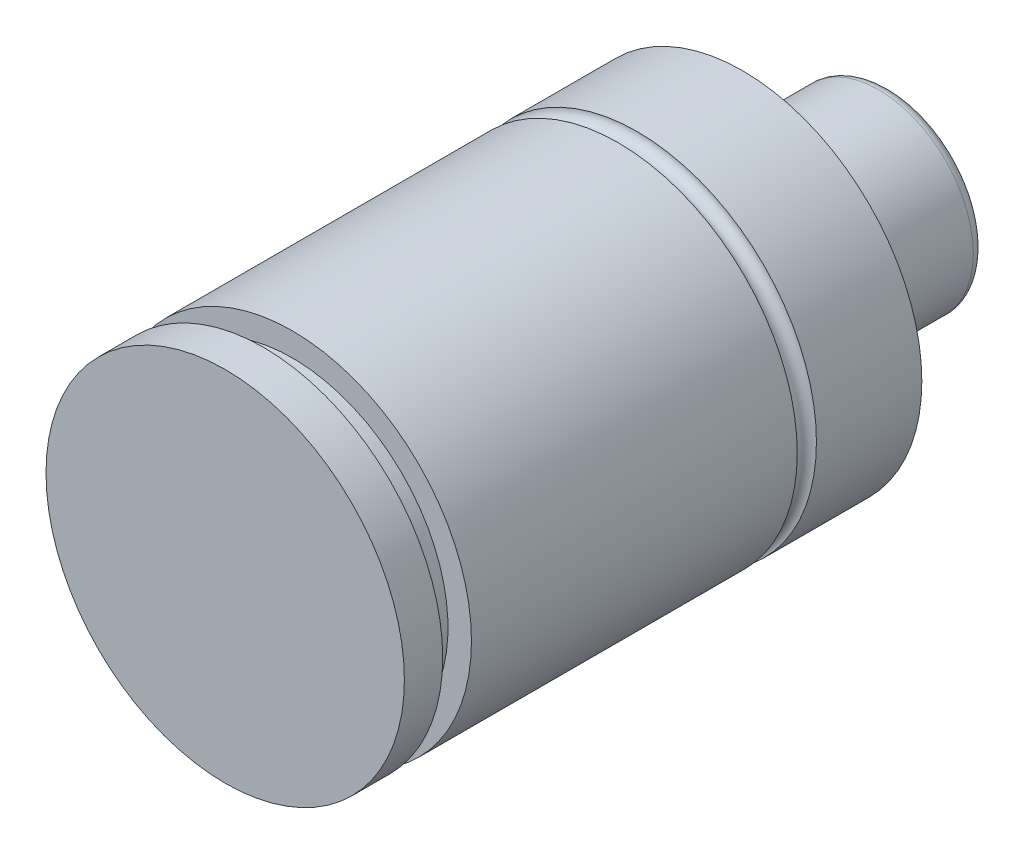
SolidWorks part; units mm, degrees
ref_plane "Front" through (0, 0, 0) normal (0, 0, 1) x (1, 0, 0)
ref_plane "Top" through (0, 0, 0) normal (0, 1, 0) x (1, 0, 0)
ref_plane "Right" through (0, 0, 0) normal (1, 0, 0) x (0, 0, -1)
sketch "Logo3_Revol_Axis" plane through (0, 0, 0) normal (0, 1, 0) x (1, 0, 0)
  line L0 (0, -30.1653) -> (0, 30.1653) construction
sketch "Logo3_bib1" plane through (0, 0, 0) normal (0, -1, 0) x (-1, 0, 0)
  line L0 (0, 70.485) -> (0, 0)
  line L1 (0, 0) -> (18.9992, 0)
  line L2 (18.9992, 0) -> (18.9992, 4.064)
  line L3 (10.033, 54.864) -> (18.9992, 54.864)
  line L4 (10.033, 54.864) -> (10.033, 69.2912)
  line L5 (8.8392, 70.485) -> (0, 70.485)
  line L6 (18.9992, 4.064) -> (16.51, 4.064)
  line L7 (16.51, 4.064) -> (16.51, 7.112)
  line L8 (16.51, 7.112) -> (18.9992, 7.112)
  line L9 (18.9992, 7.112) -> (18.9992, 41.656)
  line L10 (0, 88.0738) -> (0, -34.1764) construction
  line L11 (7.6151, 42.672) -> (28.8972, 42.672) construction
  line L12 (17.9832, 52.4707) -> (17.9832, 42.083) construction
  line L13 (18.9992, 43.688) -> (18.9992, 54.864)
  line L14 (0, 45.593) -> (10.033, 45.593) construction
  arc A0 (18.9992, 43.688) -> (18.9992, 41.656) centre (18.9992, 42.672) ccw
  arc A1 (10.033, 69.2912) -> (8.8392, 70.485) centre (8.8392, 69.2912) ccw
  dimension "logo3_r2b" = 1.016
  dimension "logo3_r0" = 1.1938
  dimension "logo3_d1" = 37.9984
  dimension "logo3_l1" = 80.01
  dimension "logo3_l0" = 54.864
  dimension "logo3_d0" = 20.066
  dimension "logo3_l2" = 12.192
  dimension "logo3_r2" = 17.9832
  dimension "logo3_r3" = 16.51
  dimension "logo3_l3" = 4.064
  dimension "logo3_th3" = 3.048
  dimension "logo3_fleche" = 24.892
revolve "Revolve1" add sketch "Logo3_bib1" angle 360 about L10
